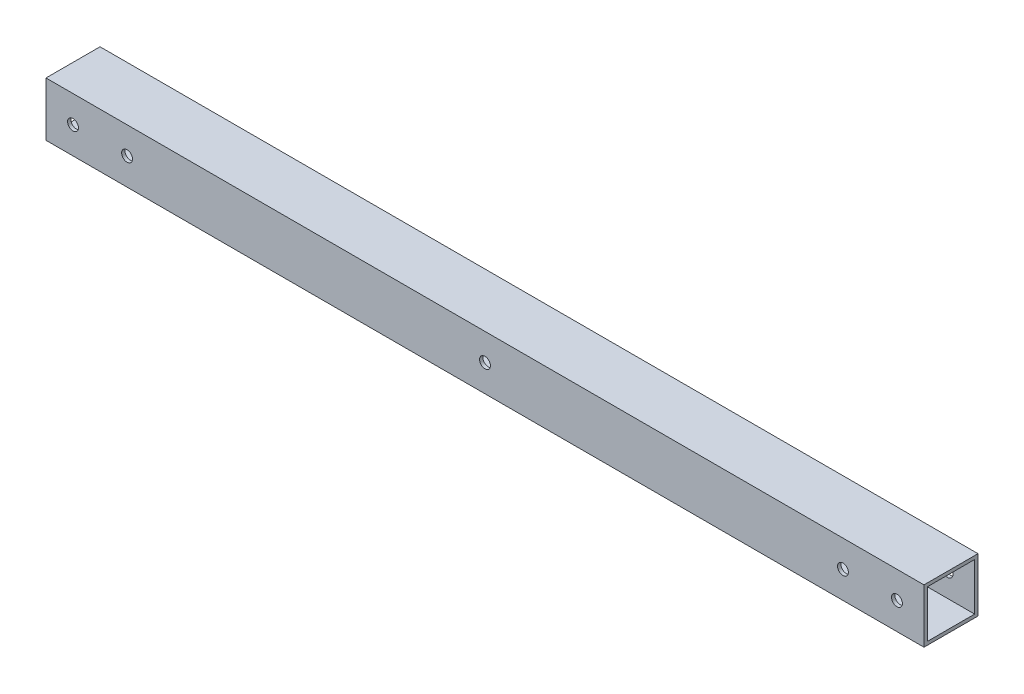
SolidWorks part; units mm, degrees
ref_plane "Front Plane" through (0, 0, 0) normal (0, 0, 1) x (1, 0, 0)
ref_plane "Top Plane" through (0, 0, 0) normal (0, 1, 0) x (1, 0, 0)
ref_plane "Right Plane" through (0, 0, 0) normal (1, 0, 0) x (0, 0, -1)
sketch "Sketch1" plane through (0, 0, 0) normal (1, 0, 0) x (0, 0, -1)
  line L1 (-12.7, -12.7) -> (12.7, -12.7)
  line L2 (-12.7, -12.7) -> (-12.7, 12.7)
  line L3 (-12.7, 12.7) -> (12.7, 12.7)
  line L4 (12.7, -12.7) -> (12.7, 12.7)
  line L5 (-12.7, -12.7) -> (12.7, 12.7) construction
  line L6 (-12.7, 12.7) -> (12.7, -12.7) construction
  line L7 (-11.1125, -11.1125) -> (11.1125, -11.1125)
  line L8 (-11.1125, -11.1125) -> (-11.1125, 11.1125)
  line L9 (-11.1125, 11.1125) -> (11.1125, 11.1125)
  line L10 (11.1125, -11.1125) -> (11.1125, 11.1125)
  line L11 (-11.1125, -11.1125) -> (11.1125, 11.1125) construction
  line L12 (-11.1125, 11.1125) -> (11.1125, -11.1125) construction
  point P0 (0, 0)
  point P6 (0, 0)
  dimension "D1" = 25.4
  dimension "D2" = 1.5875
extrude "Boss-Extrude1" add sketch "Sketch1" along normal blind 412.75
hole_wizard "#7 (0.201) Diameter Hole1" positions "Sketch2" profile "Sketch3" hole size "#7" standard "ANSI Inch"
sketch "Sketch2" plane through (0, 0, 12.7) normal (0, 0, 1) x (1, 0, 0)
  line L0 (412.75, 12.7) -> (412.75, -12.7) construction
  line L1 (0, 12.7) -> (0, -12.7) construction
  point P0 (400.05, 0)
  point P2 (374.65, 0)
  point P4 (12.7, 0)
  point P6 (38.1, 0)
  point P13 (206.375, 0)
  point P16 (0, 0)
  point P17 (0, 0)
  dimension "D1" = 12.7
  dimension "D2" = 25.4
  dimension "D3" = 12.7
  dimension "D4" = 25.4
  dimension "D5" = 206.375
sketch "Sketch3" plane through (400.05, 0, 12.7) normal (1, 0, 0) x (0, -1, 0)
  line L0 (0, 0) -> (0, 25.4)
  line L1 (0, 25.4) -> (2.5527, 25.4)
  line L2 (2.5527, 25.4) -> (2.5527, 0)
  line L5 (2.5527, 0) -> (0, 0)
  line L11 (0, -6.35) -> (0, 107.95) construction
  dimension "Thru Hole Dia." = 5.1054
  dimension "Thru Hole Depth" = 25.4
